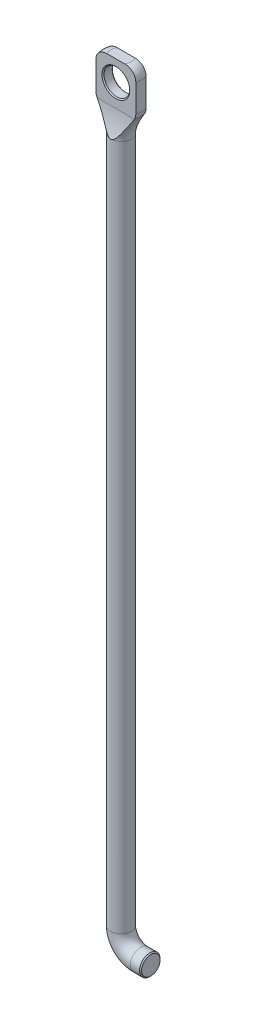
SolidWorks part; units mm, degrees
ref_plane "Спереди" through (0, 0, 0) normal (0, 0, 1) x (1, 0, 0)
ref_plane "Сверху" through (0, 0, 0) normal (0, 1, 0) x (1, 0, 0)
ref_plane "Справа" through (0, 0, 0) normal (1, 0, 0) x (0, 0, -1)
sketch "Эскиз2" plane through (0, 0, 0) normal (0, 0, 1) x (1, 0, 0)
  line L0 (0, 71.1) -> (0, 0)
  line L1 (1.9, 0) -> (1.9, -1.9) construction
  arc A0 (0, 0) -> (1.9, -1.9) centre (1.9, 0) ccw
  dimension "D1" = 3.8
  dimension "D2" = 73
ref_plane "Плоскость1" through (1.9, 0, 0) normal (1, 0, 0) x (0, 0, -1)
sketch "Эскиз4" plane through (1.9, 0, 0) normal (1, 0, 0) x (0, 0, -1)
  circle A0 centre (0, -1.9) radius 1
  dimension "D1" = 2
sweep "По траектории2" add profiles "Эскиз4" path "Эскиз2"
sketch "Эскиз5" plane through (0, 0, 0) normal (0, 0, 1) x (1, 0, 0)
  line L0 (0, 71.1) -> (0, 73.1) construction
  line L1 (1, 71.1) -> (-1, 71.1) construction
  line L2 (-2, 69.4) -> (-2, 72.1)
  line L3 (-1, 73.1) -> (0, 73.1)
  line L4 (0, 66.6) -> (-1, 66.6)
  line L5 (-1, 71.1) -> (-1, 0) construction
  line L6 (0, 67.6) -> (-1.2, 67.6) construction
  line L7 (0, 66.6) -> (0, 73.1)
  arc A0 (-2, 69.4) -> (-1.8736, 68.9134) centre (-1, 69.4) ccw
  arc A1 (-2, 72.1) -> (-1, 73.1) centre (-1, 72.1) cw
  spline S0 degree 3 poles (-1, 66.6) (-1, 67.4618) (-1.474, 68.1959) (-1.8736, 68.9134) knots 0 0 0 0 0.893154 0.893154 0.893154 0.893154
  dimension "D5" = 1
  dimension "D7" = 1
  dimension "D2" = 2
  dimension "D3" = 4.5
  dimension "D4" = 3.5
  dimension "D6" = 1.2
  dimension "D8" = 1.7
revolve "Повернуть1" add sketch "Эскиз5" angle 360 about L7
sketch "Эскиз6" plane through (0, 0, 0) normal (1, 0, 0) x (0, 0, -1)
  line L0 (0, 73.1) -> (0, 61.1407) construction
  line L1 (1, 73.1) -> (-1, 73.1) construction
  line L2 (-0.5, 73.1) -> (-0.5, 68.9134)
  line L3 (1.8736, 68.9134) -> (-1.8736, 68.9134) construction
  line L4 (0, 67.6) -> (-0.7, 67.6) construction
  line L5 (-0.5, 73.1) -> (0.5, 73.1)
  line L6 (0.5, 73.1) -> (0.5, 68.9134)
  line L7 (-1, 66.6) -> (-2.1413, 66.6)
  line L8 (-2.1413, 66.6) -> (-2.1413, 73.5847)
  line L9 (-2.1413, 73.5847) -> (2.1631, 73.5847)
  line L10 (2.1631, 73.5847) -> (2.1631, 66.6)
  line L11 (2.1631, 66.6) -> (1, 66.6)
  spline S0 degree 2 poles (-1, 66.6) (-0.5877, 67.7202) (-0.5, 68.9134) knots 0 0 0 1 1 1
  spline S1 degree 2 poles (1, 66.6) (0.5877, 67.7202) (0.5, 68.9134) knots 0 0 0 1 1 1
  dimension "D1" = 1
  dimension "D2" = 0.7
extrude "Вырез-Вытянуть1" cut sketch "Эскиз6" against normal mid plane 10
sketch "Эскиз7" plane through (0, 0, 0) normal (0, 0, 1) x (1, 0, 0)
  circle A0 centre (0, 71.1) radius 1.25
  dimension "D1" = 2.5
extrude "Вырез-Вытянуть2" cut sketch "Эскиз7" against normal mid plane 10
sketch "Эскиз8" plane through (1.9, 0, 0) normal (1, 0, 0) x (0, 0, -1)
  circle A1 centre (0, -1.9) radius 1
  circle A2 centre (0, -1.9) radius 1
  dimension "D1" = 0
extrude "Бобышка-Вытянуть1" add sketch "Эскиз8" along normal blind 1
chamfer "Фаска1" distance 0.1 angle 45 3 edges at (0, 69.85, -0.5) (0, 72.35, 0.5) (2.9, -1.9, -1)
